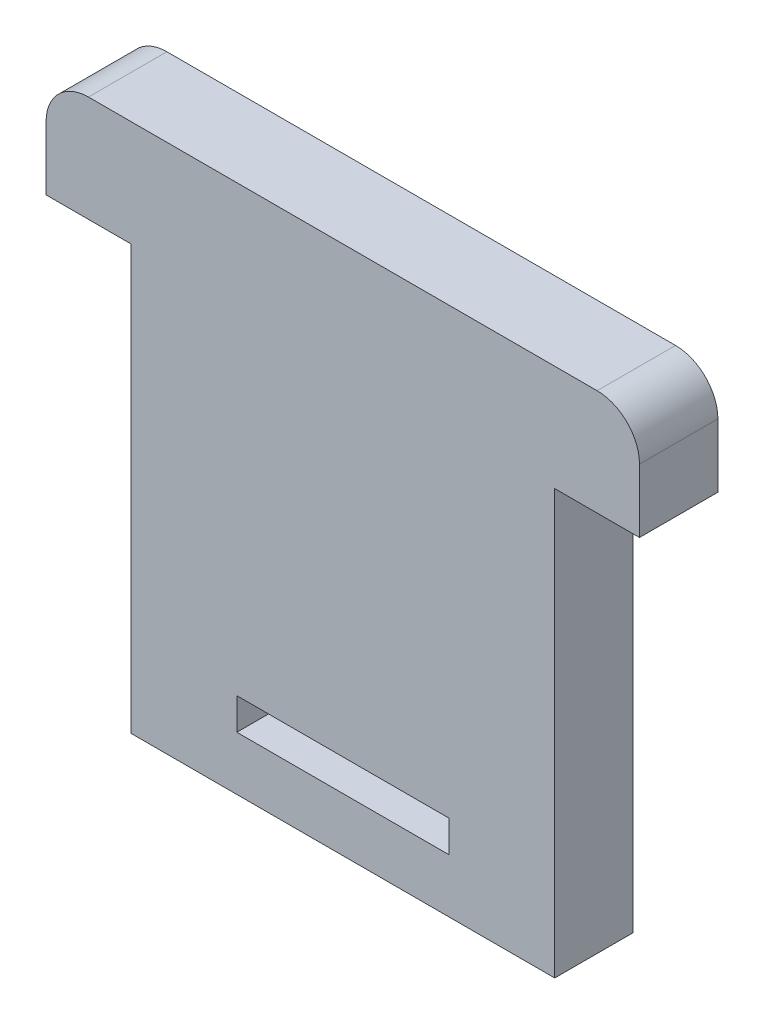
SolidWorks part; units mm, degrees
ref_plane "Front Plane" through (0, 0, 0) normal (0, 0, 1) x (1, 0, 0)
ref_plane "Top Plane" through (0, 0, 0) normal (0, 1, 0) x (1, 0, 0)
ref_plane "Right Plane" through (0, 0, 0) normal (1, 0, 0) x (0, 0, -1)
sketch "Sketch1" plane through (0, 0, 0) normal (0, 0, 1) x (1, 0, 0)
  line L1 (-12.7, 12.7) -> (12.7, 12.7)
  line L2 (-12.7, 12.7) -> (-12.7, -12.7)
  line L3 (-12.7, -12.7) -> (12.7, -12.7)
  line L4 (12.7, 12.7) -> (12.7, -12.7)
  line L5 (-12.7, 12.7) -> (12.7, -12.7) construction
  line L6 (-12.7, -12.7) -> (12.7, 12.7) construction
  line L7 (-17.78, 19.05) -> (17.78, 19.05)
  line L8 (-17.78, 19.05) -> (-17.78, 12.7)
  line L9 (-17.78, 12.7) -> (17.78, 12.7)
  line L10 (17.78, 19.05) -> (17.78, 12.7)
  line L11 (-17.78, 19.05) -> (17.78, 12.7) construction
  line L12 (-17.78, 12.7) -> (17.78, 19.05) construction
  point P0 (0, 0)
  point P6 (0, 15.875)
  dimension "D1" = 25.4
  dimension "D2" = 6.35
  dimension "D3" = 5.08
  dimension "D4" = 31.75
sketch "Sketch2" plane through (0, 0, 0) normal (0, 0, 1) x (1, 0, 0)
  line L0 (12.7, 12.7) -> (17.78, 12.7)
  line L4 (17.78, 19.05) -> (-17.78, 19.05)
  line L5 (17.78, 12.7) -> (17.78, 19.05)
  line L6 (-17.78, 12.7) -> (17.78, 12.7)
  line L7 (-17.78, 19.05) -> (-17.78, 12.7)
  line L8 (17.78, 19.05) -> (-17.78, 19.05)
  line L9 (17.78, 12.7) -> (17.78, 19.05)
  line L10 (-17.78, 12.7) -> (-12.7, 12.7)
  line L11 (-17.78, 19.05) -> (-17.78, 12.7)
  line L12 (12.7, 12.7) -> (-12.7, 12.7)
  line L13 (12.7, -12.7) -> (12.7, 12.7)
  line L14 (-12.7, -12.7) -> (12.7, -12.7)
  line L15 (-12.7, 12.7) -> (-12.7, -12.7)
  line L17 (12.7, -12.7) -> (12.7, 12.7)
  line L18 (-12.7, -12.7) -> (12.7, -12.7)
  line L19 (-12.7, 12.7) -> (-12.7, -12.7)
  dimension "D1" = 0
  dimension "D2" = 0
extrude "Boss-Extrude1" add sketch "Sketch2" along normal mid plane 4.699
sketch "Sketch3" plane through (0, 0, -2.3495) normal (0, 0, -1) x (-1, 0, 0)
  line L4 (-6.35, -9.4716) -> (6.35, -9.4716)
  line L5 (-6.35, -7.5716) -> (-6.35, -9.4716)
  line L6 (6.35, -7.5716) -> (-6.35, -7.5716)
  line L7 (6.35, -9.4716) -> (6.35, -7.5716)
  line L8 (-6.35, -9.4716) -> (6.35, -9.4716)
  line L9 (-6.35, -7.5716) -> (-6.35, -9.4716)
  line L10 (6.35, -7.5716) -> (-6.35, -7.5716)
  line L11 (6.35, -9.4716) -> (6.35, -7.5716)
  dimension "D1" = 0
extrude "Cut-Extrude1" cut sketch "Sketch3" against normal through all
fillet "Fillet1" [suppressed] radius 6.35
fillet "Fillet2" radius 2.54 2 edges at (17.78, 19.05, 0) (-17.78, 19.05, 0)
